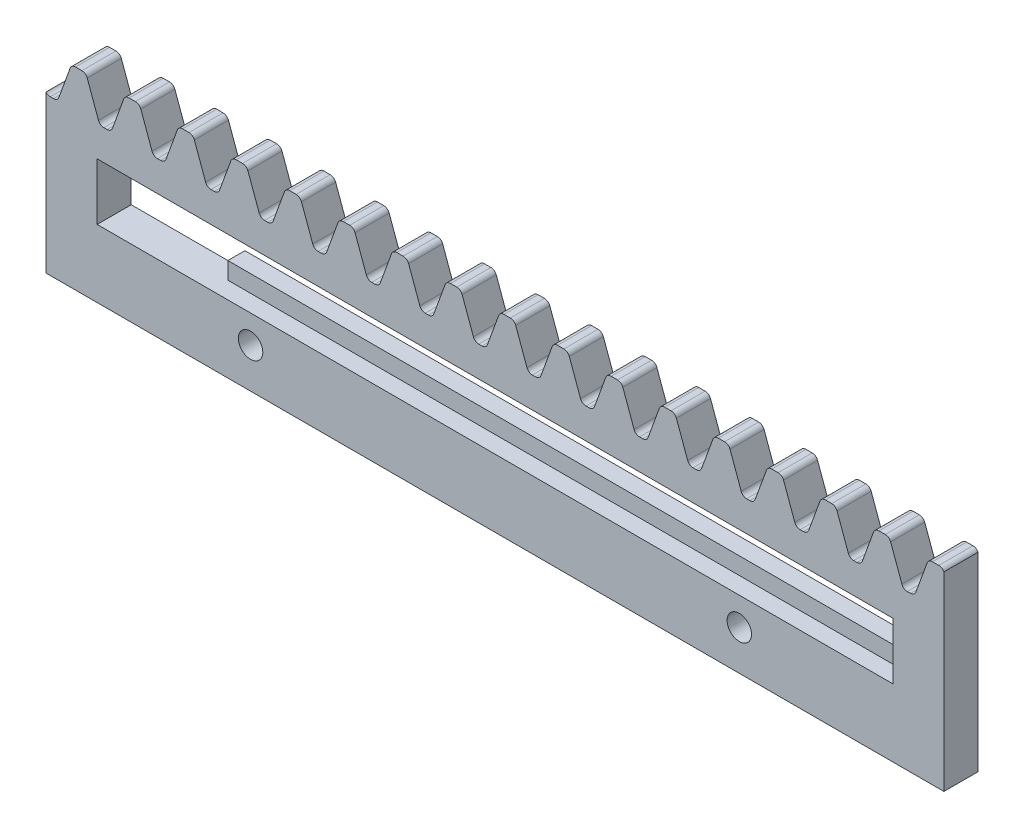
SolidWorks part; units mm, degrees
ref_plane "Front Plane" through (0, 0, 0) normal (0, 0, 1) x (1, 0, 0)
ref_plane "Top Plane" through (0, 0, 0) normal (0, 1, 0) x (1, 0, 0)
ref_plane "Right Plane" through (0, 0, 0) normal (1, 0, 0) x (0, 0, -1)
sketch "Sketch1" plane through (0, 0, 0) normal (0, 0, 1) x (1, 0, 0)
  line L0 (-50, 10) -> (-50, -10) construction
  line L1 (-50, -10) -> (50, -10) construction
  line L2 (50, -10) -> (50, 10) construction
  line L4 (0, 10) -> (0, -10) construction
  line L5 (-50, 8.5) -> (50, 8.5) construction
  line L6 (-47.756, 10) -> (-46.4917, 10) construction
  line L7 (-46.4917, 10) -> (-45.2633, 6.625) construction
  line L8 (-47.756, 10) -> (-48.9844, 6.625) construction
  line L9 (-48.9844, 6.625) -> (-45.2633, 6.625) construction
  line L10 (-47.1239, 10) -> (-47.1239, 6.625) construction
  line L11 (-50, 0) -> (-37.6991, 0) construction
  line L12 (50, 0) -> (37.6991, 0) construction
  point P15 (-42.4115, 10)
  point P16 (-10.5, -10)
  point P17 (-45.9458, 8.5)
  point P18 (-48.302, 8.5)
  point P21 (-0.75, -10)
sketch "Sketch2" plane through (0, 0, 0) normal (1, 0, 0) x (0, 0, -1)
  line L0 (-7.5, 0) -> (7.5, 0) construction
  dimension "Face Width" = 15
sketch "Sketch3" plane through (0, 0, 0) normal (0, 0, 1) x (1, 0, 0)
  line L1 (-50, 10) -> (50, 10)
  line L2 (-50, 10) -> (-50, -10)
  line L3 (-50, -10) -> (50, -10)
  line L4 (50, 10) -> (50, -10)
extrude "Boss-Extrude1" add sketch "Sketch3" against normal up to vertex (7.5 mm away) and the other way up to vertex (7.5 mm away)
sketch "Sketch4" plane through (0, 0, 0) normal (0, 0, 1) x (1, 0, 0)
  line L0 (-47.1239, 10) -> (-42.4115, 10) construction
  line L9 (-44.7677, 10) -> (-44.7677, 6.625)
  line L10 (-44.7677, 6.625) -> (-45.2633, 6.625)
  line L11 (-45.2633, 6.625) -> (-46.4917, 10)
  line L12 (-46.4917, 10) -> (-44.7677, 10)
  line L13 (-47.756, 10) -> (-48.9844, 6.625)
  line L14 (-48.9844, 6.625) -> (-49.4801, 6.625)
  line L15 (-49.4801, 6.625) -> (-49.4801, 10)
  line L16 (-49.4801, 10) -> (-47.756, 10)
  line L17 (50, 10) -> (-50, 10) construction
  line L18 (-47.756, 10) -> (-47.4036, 10)
  line L19 (-46.8441, 10) -> (-46.4917, 10)
  arc A0 (-49.3368, 6.625) -> (-48.8639, 6.9561) centre (-49.3368, 7.1283) ccw
  arc A1 (-45.3839, 6.9561) -> (-44.911, 6.625) centre (-44.911, 7.1283) ccw
  arc A2 (-47.8766, 9.6689) -> (-47.4036, 10) centre (-47.4036, 9.4967) cw
  arc A3 (-46.8441, 10) -> (-46.3712, 9.6689) centre (-46.8441, 9.4967) cw
extrude "Cut-Extrude1" cut sketch "Sketch4" against normal through all both and the other way through all contours L14 A0 L13 L16 L15 | L13 A2 L18 | L19 A3 L11 | L11 A1 L10 L9 L12
pattern_linear "LPattern1" count 22 spacing 4.7124 along (1, 0, 0) count 2 spacing 4.7124 along (-1, 0, 0) of "Cut-Extrude1"
sketch "Drawing Refernce 1" plane through (0, 0, 7.5) normal (0, 0, 1) x (1, 0, 0)
  line L0 (-50, -1.6028) -> (50, -1.6028) construction
  line L1 (-50, 6.7945) -> (-50, -10) construction
  line L2 (50, -10) -> (50, 6.7945) construction
  point P6 (-38.219, -1.6028)
  point P7 (-32.3285, -1.6028)
  point P8 (38.219, -1.6028)
ref_plane "Plane1" through (-50, -10, 7.5) normal (1, 0, 0) x (0, 0, -1)
sketch "Sketch5" plane through (-50, -10, 7.5) normal (1, 0, 0) x (0, 0, -1)
  line L1 (-2.4254, 22.3458) -> (18.1916, 22.3458)
  line L2 (-2.4254, 22.3458) -> (-2.4254, -3.1468)
  line L3 (-2.4254, -3.1468) -> (18.1916, -3.1468)
  line L4 (18.1916, 22.3458) -> (18.1916, -3.1468)
extrude "Cut-Extrude2" cut sketch "Sketch5" along normal through all from offset 79
sketch "Sketch6" plane through (0, 0, 7.5) normal (0, 0, 1) x (1, 0, 0)
  line L1 (37.319, 15.679) -> (-59.8474, 15.679)
  line L2 (37.319, 15.679) -> (37.319, -16.4195)
  line L3 (37.319, -16.4195) -> (-59.8474, -16.4195)
  line L4 (-59.8474, 15.679) -> (-59.8474, -16.4195)
extrude "Cut-Extrude3" cut sketch "Sketch6" against normal through all from offset 3
sketch "Sketch7" plane through (0, 0, 4.5) normal (0, 0, -1) x (-1, 0, 0)
  line L0 (50, -10) -> (-29, -10) construction
  line L1 (-24.5, 2.4561) -> (45.5, 2.4561)
  line L2 (-24.5, 2.4561) -> (-24.5, 0.4561)
  line L3 (-24.5, 0.4561) -> (45.5, 0.4561)
  line L4 (45.5, 2.4561) -> (45.5, 0.4561)
  line L6 (45.5, -1.0439) -> (35.5, -1.0439)
  line L7 (45.5, -1.0439) -> (45.5, 3.9561)
  line L8 (45.5, 3.9561) -> (35.5, 3.9561)
  line L9 (35.5, -1.0439) -> (35.5, 3.9561)
  point P4 (10.5, 2.4561)
  point P7 (10.5, -10)
  point P12 (45.5, 1.4561)
  point P13 (45.5, 1.4561)
  dimension "D1" = 70
  dimension "D2" = 2
  dimension "D3" = 5
  dimension "D4" = 3
  dimension "D5" = 10
extrude "Cut-Extrude4" cut sketch "Sketch7" against normal blind 10 contours L9 L3 L4 L1 | L9 L6 L7 L3 | L9 L1 L7 L8 | L3 L9 L1 L2
sketch "Sketch8" plane through (0, -10, 0) normal (0, -1, 0) x (1, 0, 0)
  line L1 (-54.9923, 13.6025) -> (38.8906, 13.6025)
  line L2 (-54.9923, 13.6025) -> (-54.9923, -3.8475)
  line L3 (-54.9923, -3.8475) -> (38.8906, -3.8475)
  line L4 (38.8906, 13.6025) -> (38.8906, -3.8475)
extrude "Cut-Extrude5" cut sketch "Sketch8" along normal blind 10 from offset 3
sketch "Sketch9" plane through (0, 0, 4.5) normal (0, 0, -1) x (-1, 0, 0)
  line L0 (-29, -7) -> (-29, 9.7301) construction
  line L1 (10.5, -7) -> (10.5, 0.4561) construction
  line L2 (-29, -7) -> (50, -7) construction
  line L3 (-24.5, 0.4561) -> (35.5, 0.4561) construction
  circle A0 centre (-11, -3.5) radius 1.075
  circle A1 centre (32, -3.5) radius 1.075
  dimension "D1" = 2.15
  dimension "D2" = 18
  dimension "D3" = 3.5
extrude "Cut-Extrude6" cut sketch "Sketch9" against normal blind 10
sketch "Sketch10" plane through (0, 0, 7.5) normal (0, 0, 1) x (1, 0, 0)
  line L0 (-35.5, -1.0439) -> (-45.5, -1.0439) construction
  line L1 (-45.5, 3.9561) -> (24.5, 3.9561)
  line L2 (-45.5, 3.9561) -> (-45.5, -1.0439)
  line L3 (-45.5, -1.0439) -> (24.5, -1.0439)
  line L4 (24.5, 3.9561) -> (24.5, -1.0439)
  line L5 (24.5, 0.4561) -> (24.5, 2.4561) construction
extrude "Cut-Extrude7" cut sketch "Sketch10" against normal blind 1.5
equation "\"Diametral Pitch\"= 1 / \"Module\""
equation "\"Pressure Angle\"=20"
equation "\"Dedendum\"= 1.25 / \"Diametral Pitch\""
equation "\"Addendum\"= 1 / \"Diametral Pitch\""
equation "\"WorkingDepth\"= 2 / \"Diametral Pitch\""
equation "\"WholeDepth\"= 2.25 / \"Diametral Pitch\""
equation "\"Clearance\"= 0.25 / \"Diametral Pitch\""
equation "\"ToothThickness\"= ( pi / 2 ) / \"Diametral Pitch\""
equation "\"CircularPitch\"= pi / \"Diametral Pitch\""
equation "\"Fillet\"= \"Clearance\" * cos ( \"Pressure Angle\" ) * tan ( ( 90 + \"Pressure Angle\" ) / 2 )"
equation "\"Module\"= 1.5"
equation "\"Addendum@Sketch1\"=\"Addendum\""
equation "\"Pressure Angle@Sketch1\"=\"Pressure Angle\""
equation "\"Dedendum@Sketch1\"=\"Dedendum\""
equation "\"Circular Pitch@Sketch1\"=\"CircularPitch\""
equation "\"Circular Tooth Thickness@Sketch1\"=\"ToothThickness\""
equation "\"Module@Sketch1\"=\"Module\""
equation "\"Approximate Number of Teeth@Sketch1\" = int ( \"Length@Sketch1\" /  ( 2 * \"Circular Tooth Thickness@Sketch1\" )  ) "
equation "\"Rack Length@Sketch1\" = \"Circular Pitch@Sketch1\" *  ( \"Approximate Number of Teeth@Sketch1\" - 1 ) "
equation "\"D3@LPattern1\"=\"CircularPitch\""
equation "\"D1@LPattern1\"=\"Approximate Number of Teeth@Sketch1\"+1"
equation "\"D1@Sketch1\"=\"Circular Pitch@Sketch1\"*2"
equation "\"D1@Sketch4\"=\"Fillet\""
equation "\"D4@LPattern1\"=\"CircularPitch\""
equation "\"D1@Drawing Refernce 1\"=\"CircularPitch\"*2.5"
equation "\"D2@Drawing Refernce 1\"=\"D1@Drawing Refernce 1\"*1.5"
equation "\"D3@Drawing Refernce 1\"=\"D1@Drawing Refernce 1\""
